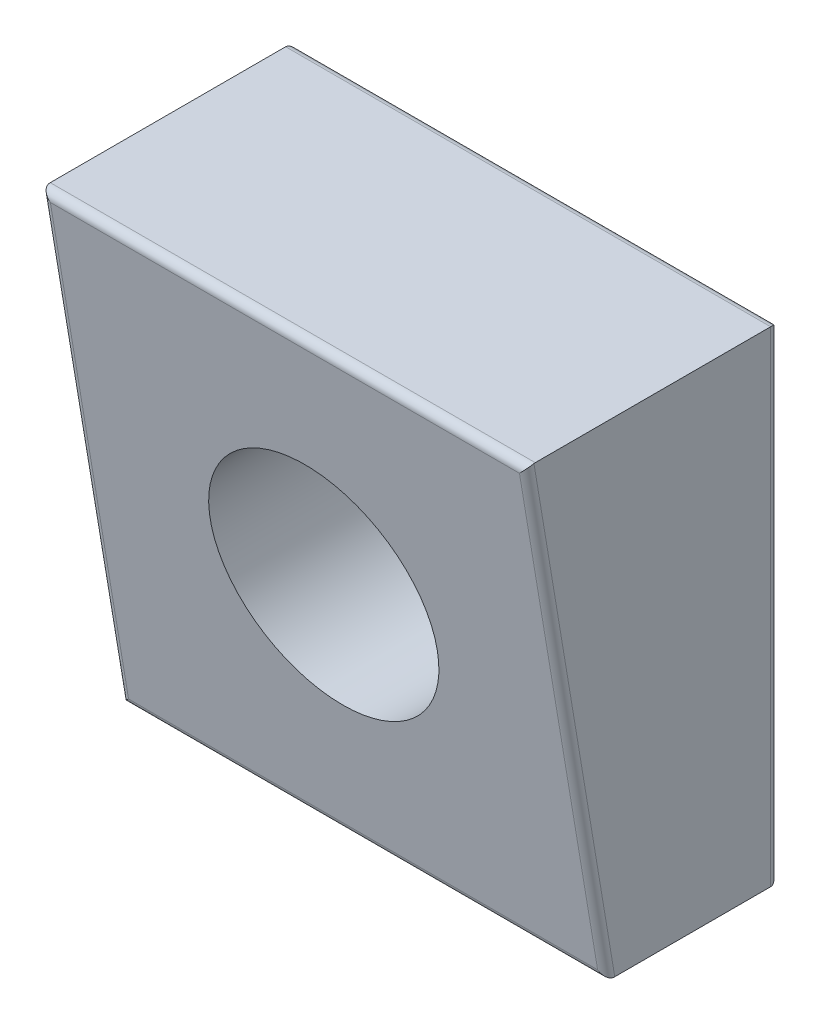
SolidWorks part; units mm, degrees
ref_plane "Front Plane" through (0, 0, 0) normal (1, 0, 0) x (0, 1, 0)
ref_plane "Top Plane" through (0, 0, 0) normal (0, 0, 1) x (0, 1, 0)
ref_plane "Right Plane" through (0, 0, 0) normal (0, 1, 0) x (-1, 0, 0)
sketch "sk C10 x 15.3" plane through (0, 0, 0) normal (1, 0, 0) x (0, 1, 0)
  line B0 (-34.732, -228.6) -> (-34.732, 25.4)
  line B1 (-34.732, 25.4) -> (31.308, 25.4)
  line B2 (-34.732, -228.6) -> (31.308, -228.6)
  line B3 (-34.732, -101.6) -> (-18.6469, -101.6) construction
  line B4 (-28.636, 2.0142) -> (-28.636, -205.2142)
  line B5 (31.308, 25.4) -> (31.308, 22.3336)
  line B6 (31.308, -228.6) -> (31.308, -225.5336)
  line B7 (-21.4199, 10.5327) -> (28.3366, 18.826)
  line B8 (-21.4199, -213.7327) -> (28.3366, -222.026)
  arc B9 (-28.636, -205.2142) -> (-21.4199, -213.7327) centre (-20, -205.2142) ccw
  arc B10 (-28.636, 2.0142) -> (-21.4199, 10.5327) centre (-20, 2.0142) cw
  arc B11 (31.308, 22.3336) -> (28.3366, 18.826) centre (27.752, 22.3336) cw
  arc B12 (31.308, -225.5336) -> (28.3366, -222.026) centre (27.752, -225.5336) ccw
  dimension "D1" = 22.3336
  dimension "D2" = 20
sketch_block_instance "C10 x 15.3-2"
sketch_block "C10 x 15.3" parameters "D3"=8.636, "D6"=3.556, "D1"=254, "D2"=66.04, "D4"=6.096, "D5"=9.463, "D7"=3.0664, "D8"=16.0851
sketch "Sketch3" plane through (0, 0, 0) normal (1, 0, 0) x (0, 1, 0)
  line L8 (-15.24, 0) -> (15.24, 0)
  line L9 (15.24, 0) -> (15.24, 15.8828)
  line L10 (15.24, 15.8828) -> (-15.24, 10.8024)
  line L11 (-15.24, 10.8024) -> (-15.24, 0)
  line L13 (-21.4199, 10.5327) -> (28.3366, 18.826) construction
  point P7 (0, 0)
  dimension "D1" = 30.48
  dimension "D2" = 0.75
sketch "Sketch1" plane through (0, 0, 0) normal (0, 0, 1) x (0, 1, 0)
  circle A0 centre (0, 0) radius 7.1374
  dimension "D1" = 14.2748
extrude "Boss-Extrude1" add sketch "Sketch3" along normal mid plane 30.48
extrude "Cut-Extrude1" cut sketch "Sketch1" along normal through all and the other way through all
fillet "Fillet1" radius 0.5 4 edges at (0, 15.24, 15.8828) (15.24, 0, 13.3426) (0, -15.24, 10.8024) (-15.24, 0, 13.3426)
fillet "Fillet2" radius 0.5 4 edges at (0, -15.24, 0) (15.24, 0, 0) (0, 15.24, 0) (-15.24, 0, 0)
